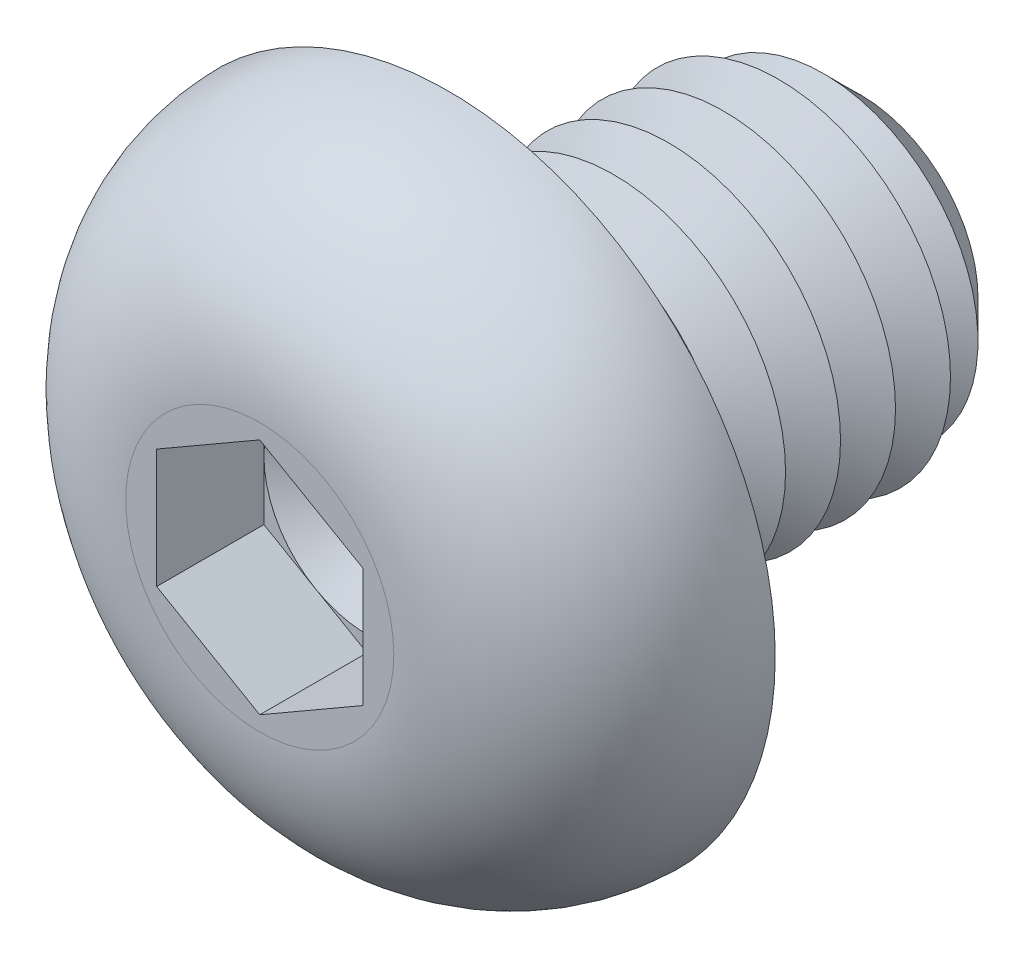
SolidWorks part; units mm, degrees
ref_plane "Front Plane" through (0, 0, 0) normal (0, 0, 1) x (1, 0, 0)
ref_plane "Top Plane" through (0, 0, 0) normal (0, 1, 0) x (1, 0, 0)
ref_plane "Right Plane" through (0, 0, 0) normal (1, 0, 0) x (0, 0, -1)
sketch "Sketch1" plane through (0, 0, 0) normal (1, 0, 0) x (0, 0, -1)
  line L0 (-47.9342, 0) -> (60.3146, 0) construction
sketch "Sketch2" plane through (0, 0, 0) normal (1, 0, 0) x (0, 0, -1)
  line L0 (0, 0) -> (-2.75, 0)
  line L1 (-47.9342, 0) -> (60.3146, 0) construction
  line L2 (-2.75, 0) -> (-2.75, 1.9504)
  line L3 (0, 4.75) -> (0, 0)
  arc A0 (-2.75, 1.9504) -> (0, 4.75) centre (0.05, 1.9504) cw
  dimension "D1" = 2.8
  dimension "D2" = 2.75
  dimension "D3" = 4.75
revolve "Revolve1" add sketch "Sketch2" angle 360 about L0
sketch "Sketch3" plane through (0, 0, 2.75) normal (0, 0, 1) x (1, 0, 0)
  line L1 (0, 1.7321) -> (-1.5, 0.866)
  line L2 (-1.5, 0.866) -> (-1.5, -0.866)
  line L3 (-1.5, -0.866) -> (0, -1.7321)
  line L4 (0, -1.7321) -> (1.5, -0.866)
  line L5 (1.5, -0.866) -> (1.5, 0.866)
  line L6 (1.5, 0.866) -> (0, 1.7321)
  circle A0 centre (0, 0) radius 1.5 construction
  dimension "D1" = 3
extrude "Cut-Extrude1" cut sketch "Sketch3" against normal blind 1.56
sketch "Sketch4" plane through (0, 0, 0) normal (0, 0, -1) x (-1, 0, 0)
  circle A0 centre (0, 0) radius 2.5
  dimension "D1" = 5
extrude "Boss-Extrude1" add sketch "Sketch4" along normal blind 6
chamfer "Chamfer1" distance 0.8 angle 45 1 edges at (-2.5, 0, -6)
sketch "Sketch5" plane through (0, 0, 0) normal (1, 0, 0) x (0, 0, -1)
  line L0 (0.8, 2.5) -> (1.6, 2.5)
  line L1 (5.2, 2.5) -> (0, 2.5) construction
  line L2 (1.6, 2.5) -> (1.2, 1.8072)
  line L3 (1.2, 1.8072) -> (0.8, 2.5)
  line L4 (0, -4.75) -> (0, 4.75) construction
  line L5 (5.2, 2.5) -> (0, 2.5) construction
  dimension "D1" = 0.8
  dimension "D2" = 0.8
revolve "Cut-Revolve1" cut sketch "Sketch5" angle 360 about L0
pattern_linear "LPattern1" count 6 spacing 0.8 along (0, 0, -1) of "Cut-Revolve1"
fillet "Fillet2" radius 0.4 1 edges at (2.5, 0, 0)
sketch "Sketch6" plane through (0, 0, 1.19) normal (0, 0, 1) x (1, 0, 0)
  line L0 (0, -1.7321) -> (1.5, -0.866) construction
  circle A0 centre (0, 0) radius 1.5
extrude "Cut-Extrude2" cut sketch "Sketch6" against normal through all draft 60
